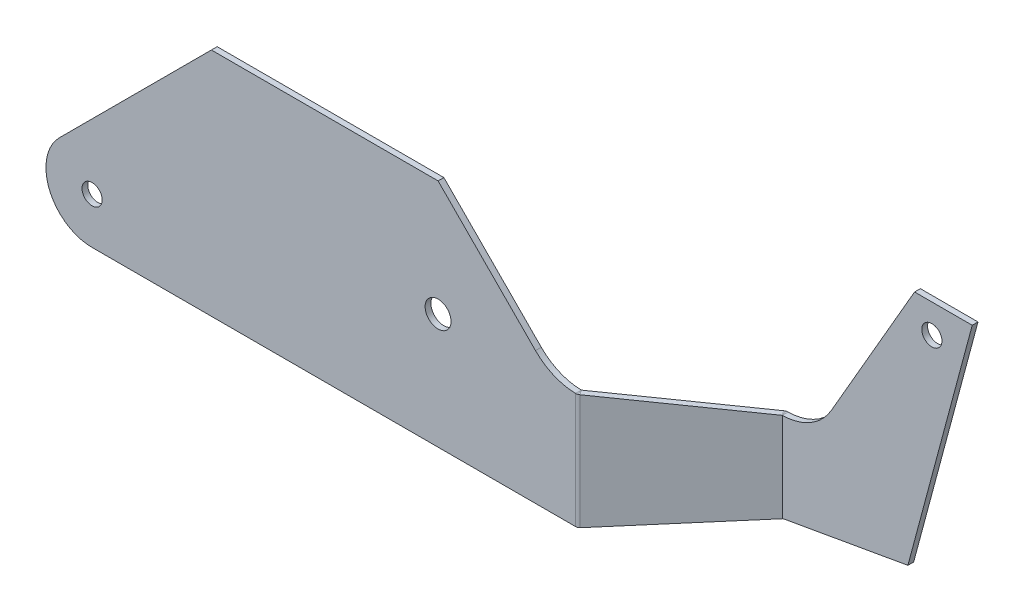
SolidWorks part; units mm, degrees
ref_plane "Front" through (0, 0, 0) normal (0, 0, 1) x (1, 0, 0)
ref_plane "Top" through (0, 0, 0) normal (0, 1, 0) x (1, 0, 0)
ref_plane "Right" through (0, 0, 0) normal (1, 0, 0) x (0, 0, -1)
sketch "Sketch1" plane through (0, 0, 0) normal (0, 0, 1) x (1, 0, 0)
  line L0 (49.5, 20) -> (24, 20)
  line L1 (24, 0) -> (71.4378, 8.3646)
  line L2 (24, 0) -> (-60, 0)
  line L4 (0, 40) -> (-39.3137, 40)
  line L5 (-65.6569, 13.6569) -> (-39.3137, 40)
  line L7 (82.594, 50) -> (72.594, 50)
  line L8 (0, 50) -> (-39.3137, 50) construction
  line L11 (0, 40) -> (16.8994, 22.9586)
  line L13 (58.1602, 25) -> (72.594, 50)
  line L16 (82.594, 50) -> (71.4378, 8.3646)
  circle A0 centre (-60, 8) radius 1.75
  arc A1 (-65.6569, 13.6569) -> (-60, 0) centre (-60, 8) ccw
  arc A2 (16.8994, 22.9586) -> (24, 20) centre (24, 30) ccw
  arc A3 (49.5, 20) -> (58.1602, 25) centre (49.5, 30) ccw
  circle A4 centre (0, 20) radius 2.25
  circle A5 centre (75.594, 45) radius 1.75
sheet metal parameters "Sheet-Metal1" thickness 1 parameters "D1"=0.01
base flange "Base-Flange1" sketch "Sketch1" thickness 1 reverse thickness direction yes parameters "D1"=0.01
sketch "Sketch3" plane through (0, 0, 1) normal (0, 0, 1) x (1, 0, 0)
  line L0 (24, 30) -> (24, 0)
sketched bend "Sketched Bend1" parameters "D1"=0.01
bend "SketchBend1" bend radius 0.01 bend angle 35 parameters "D5"=1
sketch "Sketch4" plane through (8.4191, 0, 12.0238) normal (0.5736, 0, 0.8192) x (0.8192, 0, -0.5736)
  line L0 (44.882, 28.6448) -> (44.882, -3.6636)
sketched bend "Sketched Bend2" parameters "D1"=0.01
bend "SketchBend2" bend radius 0.01 bend angle 35 parameters "D5"=2
flat pattern "Flat-Pattern1"
sketch "Bend-Lines1" plane through (0, 0, 0) normal (0, 1, 0) x (-1, 0, 0)
bend of the flat pattern "Flatten-<SketchBend1>1"
bend of the flat pattern "Flatten-<SketchBend2>1"
